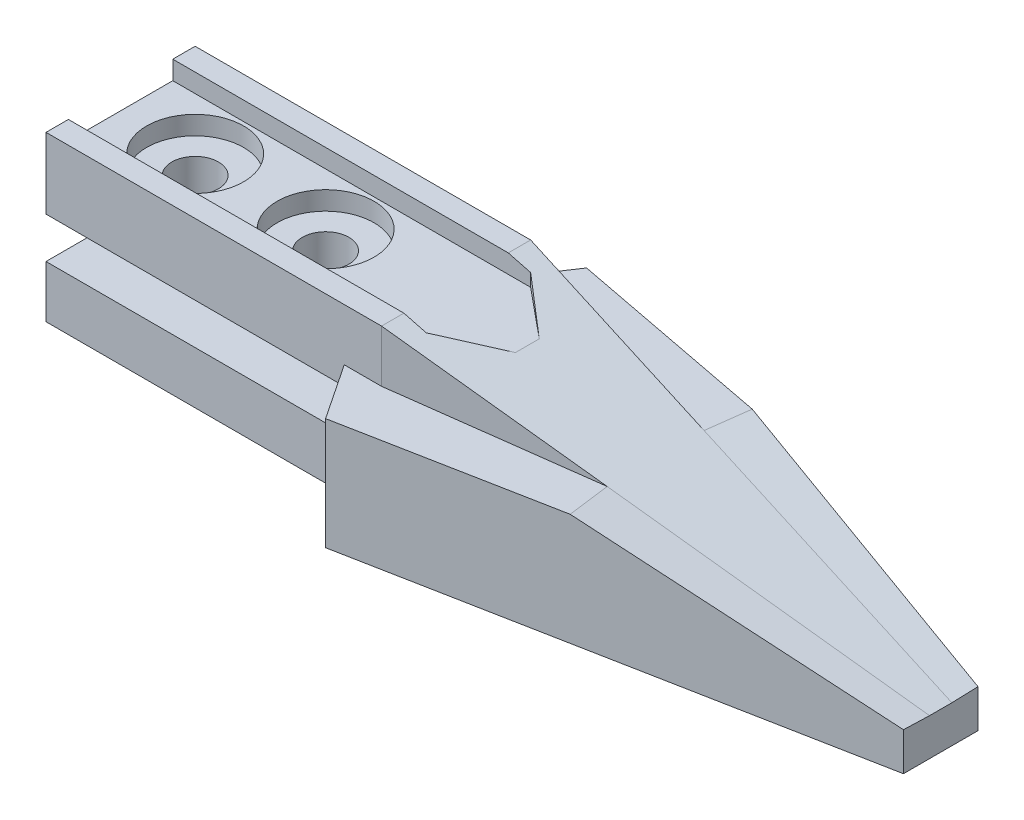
SolidWorks part; units mm, degrees
ref_plane "前视基准面" through (0, 0, 0) normal (0, 0, 1) x (1, 0, 0)
ref_plane "上视基准面" through (0, 0, 0) normal (0, 1, 0) x (1, 0, 0)
ref_plane "右视基准面" through (0, 0, 0) normal (1, 0, 0) x (0, 0, -1)
sketch "草图1" plane through (0, 0, 0) normal (0, 0, 1) x (1, 0, 0)
  line L0 (0, 0) -> (90, 0)
  line L1 (90, 0) -> (220, -34)
  line L2 (220, -34) -> (220, -44)
  line L3 (220, -44) -> (0, -44)
  line L4 (0, -44) -> (0, -30)
  line L5 (0, -19) -> (80, -19)
  line L6 (80, -19) -> (80, -30)
  line L7 (80, -30) -> (0, -30)
  line L8 (0, -19) -> (0, 0)
  dimension "D1" = 44
  dimension "D2" = 10
  dimension "D3" = 90
  dimension "D4" = 220
  dimension "D5" = 80
  dimension "D6" = 14
  dimension "D7" = 11
extrude "拉伸1" add sketch "草图1" along normal mid plane 40
sketch "草图2" plane through (0, 0, 0) normal (0, 1, 0) x (-1, 0, 0)
  line L0 (0, 20) -> (0, -20) construction
  line L1 (0, -14) -> (-96, -14)
  line L2 (0, -14) -> (0, 14)
  line L3 (0, 14) -> (-96, 14)
  line L5 (-90, -20) -> (0, -20) construction
  line L6 (-113, 0) -> (-96, 14)
  line L7 (-113, 0) -> (-96, -14)
  line L8 (-90, 20) -> (-90, -20) construction
  dimension "D2" = 28
  dimension "D3" = 6
  dimension "D4" = 6
  dimension "D5" = 6
extrude "切除-拉伸1" cut sketch "草图2" against normal blind 5
sketch "草图3" plane through (0, -5, 0) normal (0, 1, 0) x (-1, 0, 0)
  line L0 (0, 0) -> (-155.3184, 0) construction
  line L1 (0, -14) -> (0, 14) construction
  circle A0 centre (-20, 0) radius 6.25
  circle A1 centre (-55, 0) radius 6.25
  dimension "D1" = 20
  dimension "D2" = 35
  dimension "D3" = 12.5
  dimension "D4" = 12.5
extrude "切除-拉伸2" cut sketch "草图3" against normal through all
sketch "草图4" plane through (0, -5, 0) normal (0, 1, 0) x (-1, 0, 0)
  circle A0 centre (-55, 0) radius 13
  circle A1 centre (-20, 0) radius 13
  dimension "D1" = 26
  dimension "D2" = 26
extrude "切除-拉伸3" cut sketch "草图4" against normal blind 5
sketch "草图5" plane through (0, -44, 0) normal (0, -1, 0) x (1, 0, 0)
  circle A0 centre (20, 0) radius 13
  circle A1 centre (55, 0) radius 13
  dimension "D1" = 26
  dimension "D2" = 26
extrude "切除-拉伸4" cut sketch "草图5" against normal blind 5
sketch "草图8" plane through (0, 0, 0) normal (0, 1, 0) x (-1, 0, 0)
  line L0 (-90, -20) -> (-220, -3)
  line L1 (-220, 20) -> (-220, -20) construction
  line L2 (-220, -3) -> (-220, -20)
  line L3 (-220, -20) -> (-90, -20)
  line L4 (-90, 20) -> (-220, 20)
  line L5 (-220, 20) -> (-220, 3)
  line L6 (-220, 3) -> (-90, 20)
  dimension "D1" = 3
  dimension "D2" = 6
extrude "切除-拉伸6" cut sketch "草图8" against normal through all
sketch "草图9" plane through (0, -44, 0) normal (0, -1, 0) x (1, 0, 0)
  line L0 (80, -20) -> (90, -35)
  line L1 (0, -20) -> (90, -20) construction
  line L2 (90, -35) -> (220, -10)
  line L3 (220, -10) -> (220, -3)
  line L5 (0, 20) -> (0, -20) construction
  line L12 (220, -3) -> (220, 3)
  line L13 (220, 3) -> (90, 20)
  line L14 (90, 20) -> (0, 20)
  line L15 (0, 20) -> (0, -20)
  line L16 (0, -20) -> (90, -20)
  line L17 (90, -20) -> (220, -3)
  line L22 (80, -20) -> (90, -20)
  line L23 (90, -20) -> (220, -3)
  dimension "D1" = 7
  dimension "D2" = 80
  dimension "D3" = 35
  dimension "D4" = 10
  dimension "D5" = 0
extrude "拉伸2" add sketch "草图9" against normal blind 30
sketch "草图10" plane through (4.0846, 0, -31.2351) normal (-0.1297, 0, 0.9916) x (0.9916, 0, 0.1297)
  line L3 (140.6321, -14) -> (217.7537, -34)
  line L4 (217.7537, -34) -> (217.7537, -14)
  line L5 (217.7537, -14) -> (140.6321, -14)
  line L6 (140.6321, -14) -> (217.7537, -34)
  line L7 (217.7537, -34) -> (217.7537, -14)
  line L8 (217.7537, -14) -> (140.6321, -14)
  dimension "D1" = 0
extrude "切除-拉伸7" cut sketch "草图10" against normal through all
mirror "镜向1" about plane through (0, 0, 0) normal (0, 0, 1) of "切除-拉伸7", "拉伸2"
